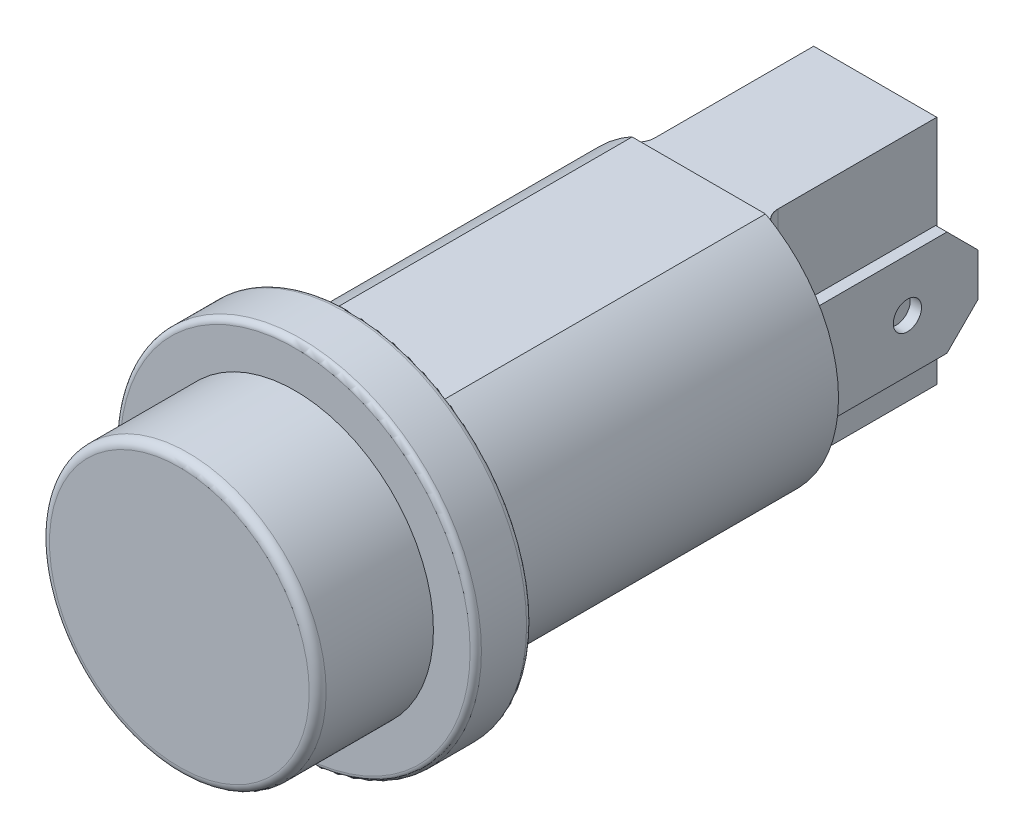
SolidWorks part; units mm, degrees
ref_plane "Front" through (0, 0, 0) normal (0, 0, 1) x (1, 0, 0)
ref_plane "Top" through (0, 0, 0) normal (0, 1, 0) x (1, 0, 0)
ref_plane "Right" through (0, 0, 0) normal (1, 0, 0) x (0, 0, -1)
sketch "Sketch1" plane through (0, 0, 0) normal (1, 0, 0) x (0, 0, -1)
  line L0 (-11.684, 0) -> (11.684, 0) construction
  line L1 (-3.937, 6.2865) -> (11.684, 6.2865)
  line L2 (-11.684, 5.842) -> (-11.684, 0)
  line L3 (-11.303, 6.223) -> (-6.477, 6.223)
  line L4 (11.684, 6.2865) -> (11.684, 0)
  line L5 (-6.477, 6.223) -> (-6.477, 7.874)
  line L6 (-6.223, 8.128) -> (-4.191, 8.128)
  line L7 (-3.937, 7.874) -> (-3.937, 6.2865)
  line L8 (-11.684, 0) -> (11.684, 0)
  arc A0 (-6.477, 7.874) -> (-6.223, 8.128) centre (-6.223, 7.874) cw
  arc A1 (-4.191, 8.128) -> (-3.937, 7.874) centre (-4.191, 7.874) cw
  arc A2 (-11.303, 6.223) -> (-11.684, 5.842) centre (-11.303, 5.842) ccw
  dimension "D6" = 0.254
  dimension "D8" = 0.381
  dimension "D1" = 11.684
  dimension "D2" = 6.2865
  dimension "D3" = 6.223
  dimension "D4" = 8.128
  dimension "D5" = 2.54
  dimension "D7" = 5.207
revolve "Revolve1" add sketch "Sketch1" angle 360 about L0
sketch "Sketch2" plane through (0, 0, -11.684) normal (0, 0, -1) x (-1, 0, 0)
  line L0 (-4.0635, 5.5245) -> (4.0635, 5.5245)
  arc A0 (4.0635, 5.5245) -> (-4.0635, 5.5245) centre (0, 0) ccw
  dimension "D1" = 13.716
  dimension "D2" = 5.5245
extrude "Cut-Extrude1" cut sketch "Sketch2" against normal up to surface (15.621 mm away)
sketch "Sketch3" plane through (0, 0, -11.684) normal (0, 0, -1) x (-1, 0, 0)
  line L1 (-2.7686, 5.207) -> (2.7686, 5.207)
  line L2 (-2.7686, 5.207) -> (-2.7686, -5.207)
  line L3 (-2.7686, -5.207) -> (2.7686, -5.207)
  line L4 (4.6228, -2.3622) -> (4.1148, -2.3622)
  line L5 (0, 0) -> (0, -8.128) construction
  line L6 (2.7686, 5.207) -> (2.7686, -5.207)
  line L7 (-4.6228, 2.3622) -> (-4.1148, 2.3622)
  line L8 (-4.6228, 2.3622) -> (-4.6228, -2.3622)
  line L9 (-4.6228, -2.3622) -> (-4.1148, -2.3622)
  line L10 (-4.1148, 2.3622) -> (-4.1148, -2.3622)
  line L11 (4.1148, 2.3622) -> (4.1148, -2.3622)
  line L12 (4.6228, 2.3622) -> (4.1148, 2.3622)
  line L13 (4.6228, 2.3622) -> (4.6228, -2.3622)
  circle A0 centre (0, 0) radius 8.128 construction
  point P4 (-2.7686, 0)
  point P5 (0, 5.207)
  point P18 (-4.6228, 0)
  dimension "D1" = 2.7686
  dimension "D2" = 10.414
  dimension "D3" = 4.7244
  dimension "D4" = 0.508
  dimension "D5" = 4.1148
extrude "Extrude1" add sketch "Sketch3" along normal blind 7.9375
fillet "Fillet1" radius 0.7937 2 edges at (-2.7686, 0, -11.684) (2.7686, 0, -11.684)
chamfer "Chamfer1" distance 1.397 angle 45 4 edges at (-4.3688, -2.3622, -19.6215) (-4.3688, 2.3622, -19.6215) (4.3688, 2.3622, -19.6215) (4.3688, -2.3622, -19.6215)
other "Hole1" parameters "D1"=0.762
sketch "Sketch5" plane through (4.6228, 0, 0) normal (1, 0, 0) x (0, 0, -1)
  line L0 (19.6215, 0) -> (11.684, 0) construction
  line L1 (19.6215, 0.9652) -> (19.6215, -0.9652) construction
  line L2 (11.684, 2.3622) -> (11.684, -2.3622) construction
  circle A0 centre (16.4465, 0) radius 0.635
  dimension "D1" = 1.27
  dimension "D2" = 3.175
mirror "Mirror1" about plane through (0, 0, 0) normal (1, 0, 0) of "Hole1"
ref_plane "Plane1" through (4.3688, 0, 0) normal (1, 0, 0) x (0, 0, -1)
ref_plane "Plane2" through (-4.3688, 0, 0) normal (1, 0, 0) x (0, 0, -1)
